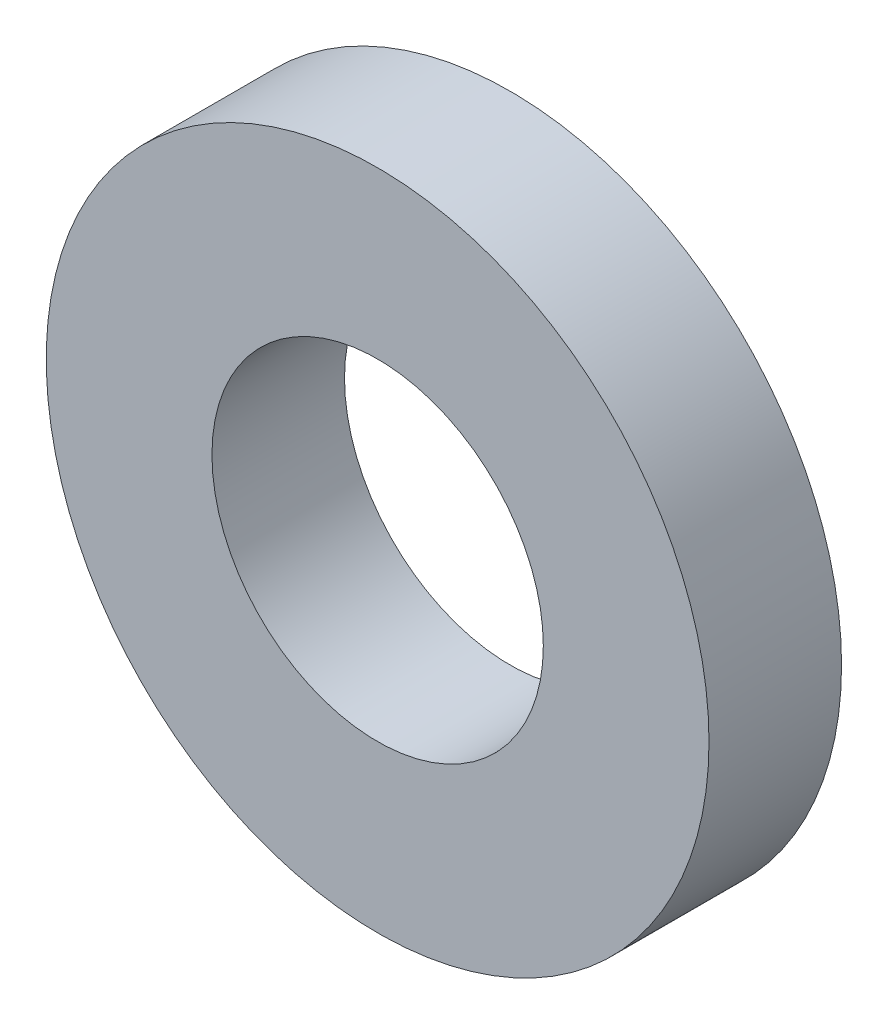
SolidWorks part; units mm, degrees
ref_plane "Plan de face" through (0, 0, 0) normal (0, 0, 1) x (1, 0, 0)
ref_plane "Plan de dessus" through (0, 0, 0) normal (0, 1, 0) x (1, 0, 0)
ref_plane "Plan de droite" through (0, 0, 0) normal (1, 0, 0) x (0, 0, -1)
sketch "Esquisse1" plane through (0, 0, 0) normal (0, 0, 1) x (1, 0, 0)
  circle A0 centre (0, 0) radius 12.5
  circle A1 centre (0, 0) radius 25
  dimension "D1" = 50
  dimension "D2" = 25
extrude "Extrusion1" add sketch "Esquisse1" along normal blind 10
